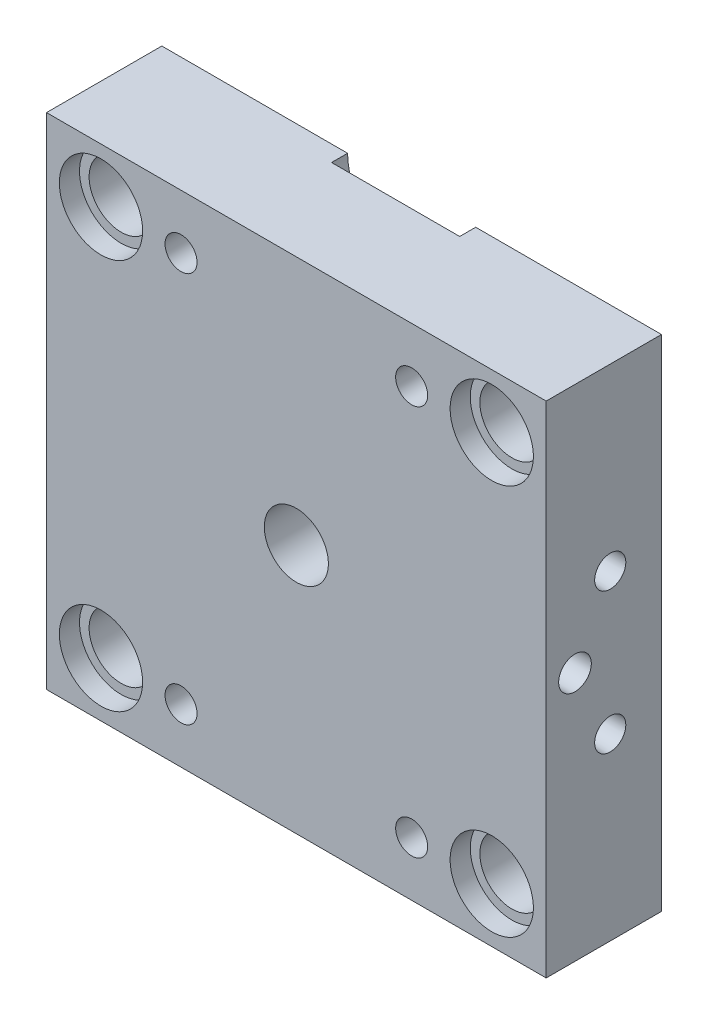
SolidWorks part; units mm, degrees
ref_plane "Plan de face" through (0, 0, 0) normal (0, 0, 1) x (1, 0, 0)
ref_plane "Plan de dessus" through (0, 0, 0) normal (0, 1, 0) x (1, 0, 0)
ref_plane "Plan de droite" through (0, 0, 0) normal (1, 0, 0) x (0, 0, -1)
sketch "Esquisse1" plane through (0, 0, 0) normal (0, 0, 1) x (1, 0, 0)
  line L1 (-78, 78) -> (78, 78)
  line L2 (-78, 78) -> (-78, -78)
  line L3 (-78, -78) -> (78, -78)
  line L4 (78, 78) -> (78, -78)
  point P4 (0, 78)
  point P6 (-78, 0)
  dimension "D1" = 156
  dimension "D2" = 156
extrude "Extrusion1" add sketch "Esquisse1" along normal blind 36
sketch "Esquisse2" plane through (0, 0, 0) normal (0, 0, 1) x (1, 0, 0)
  circle A0 centre (-61, 61) radius 10
  dimension "D1" = 20
  dimension "D3" = 61
  dimension "D2" = 61
extrude "Enlèv. mat.-Extru.2" cut sketch "Esquisse2" along normal through all
sketch "Esquisse3" plane through (0, 0, 36) normal (0, 0, 1) x (1, 0, 0)
  circle A0 centre (-61, 61) radius 13
  dimension "D1" = 26
extrude "Enlèv. mat.-Extru.3" cut sketch "Esquisse3" against normal blind 6.3
hole_wizard "Trou taraudé M10x1.51" positions "Esquisse7" profile "Esquisse6" tap size "M10x1.5" standard "Ansi Métrique"
sketch "Esquisse7" plane through (0, 0, 36) normal (0, 0, 1) x (1, 0, 0)
  point P0 (-36, 61)
  dimension "D1" = 61
  dimension "D2" = 36
sketch "Esquisse6" plane through (-36, 61, 36) normal (1, 0, 0) x (0, -1, 0)
  line L0 (0, 0) -> (0, 22.5537)
  line L1 (0, 22.5537) -> (4.25, 20)
  line L2 (4.25, 20) -> (4.25, 15)
  line L3 (4.25, 15) -> (5, 15)
  line L4 (5, 15) -> (5, 0)
  line L5 (5, 0) -> (0, 0)
  line L10 (0, 22.5537) -> (-4.25, 20) construction
  line L11 (0, -6.35) -> (0, 107.95) construction
  dimension "Diamètre du trou pour taraudage" = 8.5
  dimension "Profondeur du trou pour taraudage" = 20
  dimension "Diamètre principal du filetage" = 10
  dimension "Profondeur du filetage" = 15
  dimension "Angle de pointe" = 118
mirror "Symétrie1" about plane through (0, 0, 0) normal (1, 0, 0) of "Enlèv. mat.-Extru.3", "Enlèv. mat.-Extru.2", "Trou taraudé M10x1.51"
mirror "Symétrie2" about plane through (0, 0, 0) normal (0, 1, 0) of "Symétrie1", "Enlèv. mat.-Extru.2", "Enlèv. mat.-Extru.3", "Trou taraudé M10x1.51"
sketch "Esquisse9" plane through (0, 0, 0) normal (0, 0, -1) x (-1, 0, 0)
  line L0 (-78, 78) -> (78, 78) construction
  line L1 (78, -78) -> (-78, -78) construction
  line L2 (-20, 78) -> (20, 78)
  line L3 (-20, -78) -> (20, -78)
  arc A0 (-20, 78) -> (20, 78) centre (0, 78) ccw
  arc A1 (20, -78) -> (-20, -78) centre (0, -78) ccw
  dimension "D1" = 20
  dimension "D2" = 20
extrude "passage pinces" cut sketch "Esquisse9" against normal blind 5
hole_wizard "Trou taraudé M12x1.751" positions "Esquisse16" profile "Esquisse15" tap size "M12x1.75" standard "Ansi Métrique"
sketch "Esquisse16" plane through (78, 0, 0) normal (1, 0, 0) x (0, 0, -1)
  line L0 (0, -78) -> (0, 78) construction
  point P0 (-27, 0)
  dimension "D1" = 27
sketch "Esquisse15" plane through (78, 0, 27) normal (0, 1, 0) x (0, 0, -1)
  line L0 (0, 0) -> (0, 28.0644)
  line L1 (0, 28.0644) -> (5.1, 25)
  line L2 (5.1, 25) -> (5.1, 0)
  line L5 (5.1, 0) -> (0, 0)
  line L10 (0, 28.0644) -> (-5.1, 25) construction
  line L11 (0, -6.35) -> (0, 107.95) construction
  dimension "Diamètre du trou pour taraudage" = 10.2
  dimension "Profondeur du trou pour taraudage" = 25
  dimension "Angle de pointe" = 118
hole_wizard "Trou taraudé 1/8 Rc1" positions "Esquisse18" profile "Esquisse17" size "1/8" standard "ISO"
sketch "Esquisse18" plane through (-78, 0, 0) normal (-1, 0, 0) x (0, 0, 1)
  line L0 (0, 78) -> (0, -78) construction
  point P0 (16, 22)
  point P2 (16, -22)
  point P5 (0, 0)
  dimension "D1" = 44
  dimension "D2" = 22
  dimension "D3" = 16
sketch "Esquisse17" plane through (-78, 22, 16) normal (0, 1, 0) x (0, 0, 1)
  line L0 (0, 0) -> (0, 80.3734)
  line L1 (3.95, 78) -> (0, 80.3734)
  line L2 (-3.95, 78) -> (0, 80.3734) construction
  line L3 (3.95, 78) -> (3.95, 7.4)
  line L4 (3.95, 7.4) -> (4.633, 7.4)
  line L5 (4.633, 7.4) -> (4.864, 0)
  line L6 (-4.633, 7.4) -> (-4.864, 0) construction
  line L7 (4.864, 0) -> (0, 0)
  line L8 (0, -6.35) -> (0, 107.95) construction
  line L11 (-3.95, 7.4) -> (-4.633, 7.4) construction
  dimension "Diamètre du trou pour taraudage" = 7.9
  dimension "Profondeur du trou pour taraudage" = 78
  dimension "Diamètre du filetage" = 9.728
  dimension "Angle de filetage" = 3.576
  dimension "Profondeur du filetage" = 7.4
  dimension "Angle de pointe" = 118
mirror "Symétrie3" about plane through (0, 0, 0) normal (1, 0, 0) of "Trou taraudé 1/8 Rc1"
sketch "Esquisse19" plane through (0, 0, 0) normal (0, 0, -1) x (-1, 0, 0)
  circle A0 centre (0, 0) radius 10
  dimension "D1" = 20
extrude "Enlèv. mat.-Extru.4" cut sketch "Esquisse19" against normal through all
sketch "Esquisse23" plane through (0, 0, 0) normal (0, 0, -1) x (-1, 0, 0)
  line L0 (-26.2, 1.5) -> (-23, 1.5)
  line L1 (-23, -1.5) -> (-26.2, -1.5)
  line L2 (-26.2, -1.5) -> (-26.2, 1.5)
  arc A0 (-23, 1.5) -> (-23, -1.5) centre (-23, 0) cw
  point P4 (-26.2, 0)
  dimension "D2" = 3
  dimension "D1" = 23
  dimension "D3" = 3.2
extrude "Enlèv. mat.-Extru.5" cut sketch "Esquisse23" against normal blind 0.3
mirror "Symétrie4" about plane through (0, 0, 0) normal (1, 0, 0) of "Enlèv. mat.-Extru.5"
other "Empreinte1"
other "Embout_guidon_R1-5<1>@creation empreintes"
other "Embout_guidon_R1-5<2>@creation empreintes"
ref_plane "Plan1" through (0, 0, 4.0619) normal (0, 0, 1) x (1, 0, 0)
sketch "Esquisse24" plane through (0, 0, 0) normal (0, 0, -1) x (-1, 0, 0)
  circle A0 centre (40, 0) radius 5
  circle A1 centre (-40, 0) radius 5
  dimension "D1" = 10
extrude "Enlèv. mat.-Extru.6" cut sketch "Esquisse24" against normal up to surface (4.0619 mm away)
